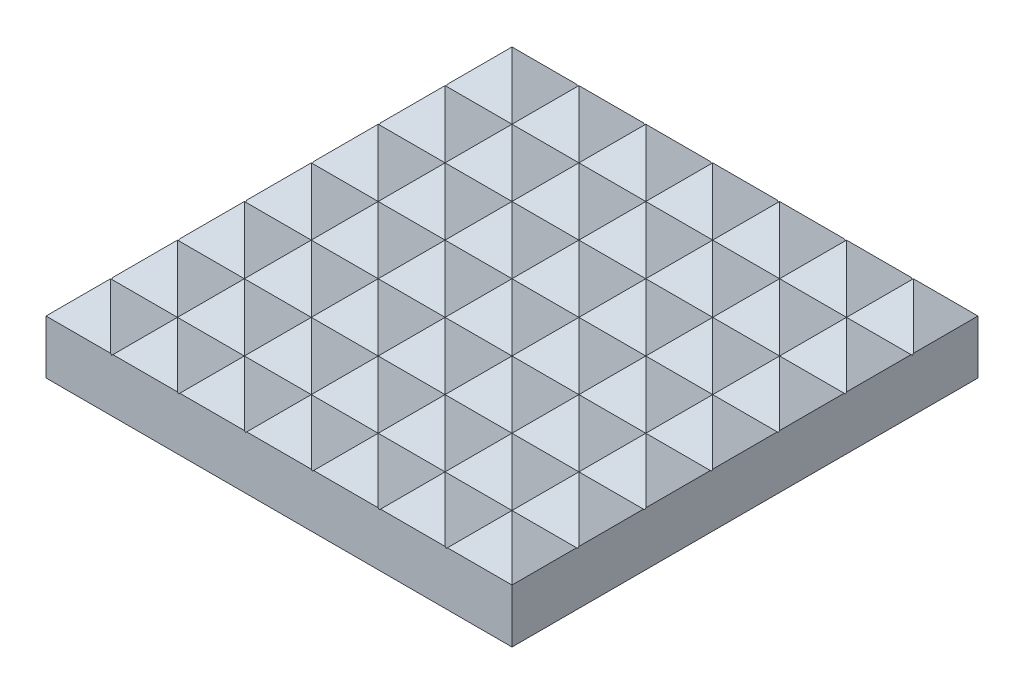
SolidWorks part; units mm, degrees
ref_plane "Front Plane" through (0, 0, 0) normal (0, 0, 1) x (1, 0, 0)
ref_plane "Top Plane" through (0, 0, 0) normal (0, 1, 0) x (1, 0, 0)
ref_plane "Right Plane" through (0, 0, 0) normal (1, 0, 0) x (0, 0, -1)
sketch "Sketch1" plane through (0, 0, 0) normal (0, 1, 0) x (1, 0, 0)
  line L0 (-7.94, -7.94) -> (-7.94, 7.94)
  line L1 (0, 0) -> (0, 50000) construction
  line L2 (0, 0) -> (50000, 0) construction
  line L3 (-7.94, 7.94) -> (7.94, 7.94)
  line L4 (7.94, -7.94) -> (7.94, 7.94)
  line L5 (-7.94, -7.94) -> (7.94, -7.94)
  point P10 (0, 7.94)
  point P11 (7.94, 0)
  point P12 (-7.94, 0)
  dimension "D1" = 15.88
  dimension "D2" = 15.88
extrude "Extrude1" add sketch "Sketch1" along normal mid plane 3.18
sketch "Sketch2" plane through (0, 0, 7.94) normal (0, 0, 1) x (1, 0, 0)
  line L0 (-7.98, 1.59) -> (-9.12, 1.59)
  line L1 (-9.12, 1.59) -> (-7.98, 0.45)
  line L2 (-7.94, -1.59) -> (7.94, -1.59) construction
  line L3 (-7.98, 0.45) -> (-6.84, 1.59)
  line L5 (-6.84, 1.59) -> (-7.98, 1.59)
  line L10 (-7.94, 1.59) -> (-7.94, -1.59) construction
  dimension "D1" = 2.28
  dimension "D2" = 1.18
  dimension "D3" = 3.18
extrude "Extrude3" cut sketch "Sketch2" against normal through all
pattern_linear "LPattern2" count 8 spacing 2.28 along (0.7071, -0.7071, 0) of "Extrude3"
sketch "Sketch3" plane through (7.94, 0, 0) normal (1, 0, 0) x (0, 0, -1)
  line L0 (-7.98, 1.59) -> (-6.84, 1.59)
  line L2 (-6.84, 1.59) -> (-7.98, 0.45)
  line L3 (-7.98, 0.45) -> (-9.12, 1.59)
  line L4 (-9.12, 1.59) -> (-7.98, 1.59)
  line L5 (-7.94, 0.49) -> (-7.94, -1.59) construction
  line L6 (7.94, 0.49) -> (-7.94, 0.49) construction
  line L8 (-7.94, -1.59) -> (7.94, -1.59) construction
  dimension "D1" = 2.28
  dimension "D2" = 1.18
  dimension "D3" = 3.18
extrude "Extrude4" cut sketch "Sketch3" against normal through all
pattern_linear "LPattern3" count 8 spacing 2.28 along (0, -0.7071, -0.7071) of "Extrude4"
chamfer "Chamfer1" distance 0.25 angle 45 4 edges at (-7.94, -1.59, 0) (0, -1.59, -7.94) (7.94, -1.59, 0) (0, -1.59, 7.94)
equation "\"D2@Sketch1\" = \"D1@Sketch1\""
equation "\"D1@Sketch3\" = \"D1@Sketch2\""
equation "\"D2@Sketch3\" = \"D2@Sketch2\""
equation "\"D3@Sketch3\" = \"D1@Extrude1\""
equation "\"D3@Sketch2\" = \"D1@Extrude1\""
